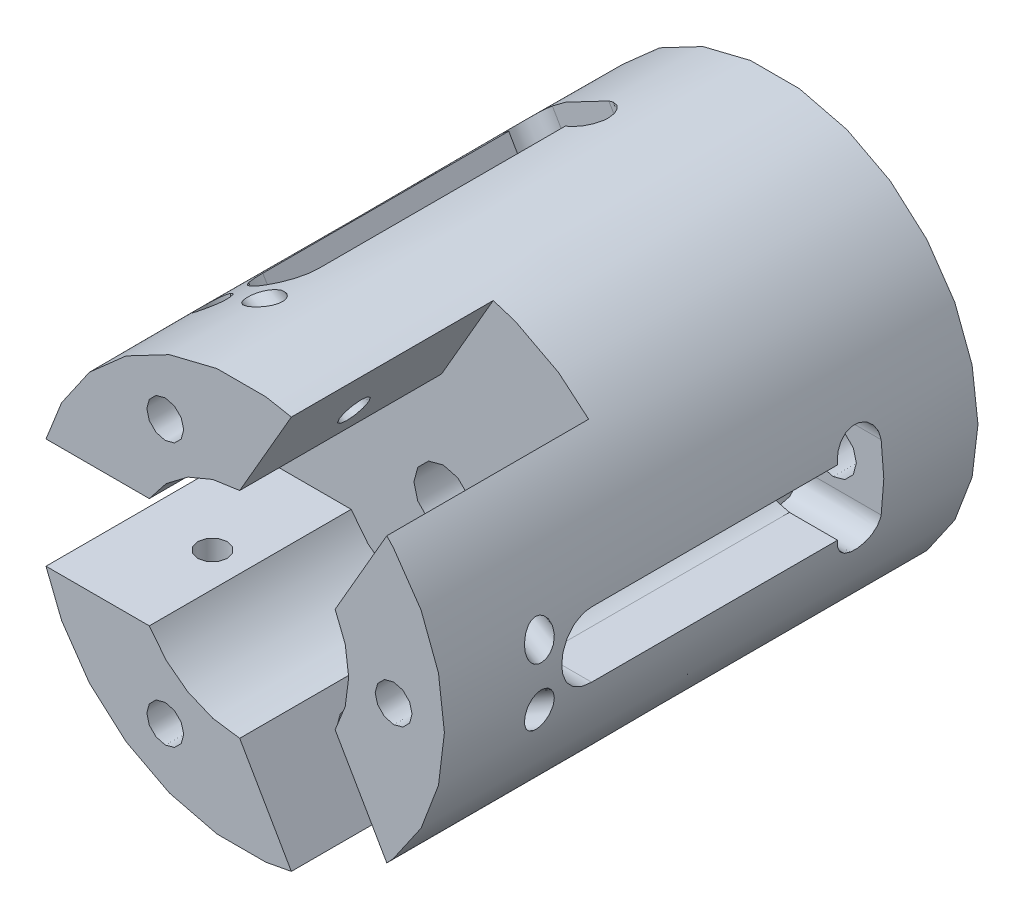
SolidWorks part; units mm, degrees
ref_plane "Front Plane" through (0, 0, 0) normal (0, 0, 1) x (1, 0, 0)
ref_plane "Top Plane" through (0, 0, 0) normal (0, 1, 0) x (1, 0, 0)
ref_plane "Right Plane" through (0, 0, 0) normal (1, 0, 0) x (0, 0, -1)
sketch "Sketch1" plane through (0, 0, 0) normal (0, 0, 1) x (1, 0, 0)
  circle A0 centre (0, 0) radius 22.225
  dimension "D1" = 44.45
extrude "Extrude1" add sketch "Sketch1" along normal blind 58.42
sketch "Sketch2" plane through (0, 0, 58.42) normal (0, 0, 1) x (1, 0, 0)
  line L1 (-24.77, 6.0325) -> (-3.8154, 6.0325)
  line L2 (-24.77, 6.0325) -> (-24.77, -6.0325)
  line L3 (-24.77, -6.0325) -> (-3.8154, -6.0325)
  line L4 (-3.8154, 6.0325) -> (-3.8154, -6.0325)
  dimension "D1" = 6.0325
  dimension "D2" = 12.065
extrude "Cut-Extrude1" cut sketch "Sketch2" against normal blind 22.098
pattern_circular "CirPattern1" count 3 over 360 about axis through (0, 0, 0) along (0, 0, 1) of "Cut-Extrude1"
sketch "Sketch3" plane through (0, 0, 58.42) normal (0, 0, 1) x (1, 0, 0)
  circle A0 centre (0, 0) radius 11.7475
  dimension "D1" = 23.495
extrude "Cut-Extrude2" cut sketch "Sketch3" against normal blind 22.098
hole_wizard "#10-32 Tapped Hole1" positions "Sketch5" profile "Sketch4" tap size "#10-32" standard "Ansi Inch"
sketch "Sketch5" plane through (0, 0, 58.42) normal (0, 0, 1) x (1, 0, 0)
  point P0 (16.6687, 0)
  dimension "D1" = 16.6687
sketch "Sketch4" plane through (16.6687, 0, 58.42) normal (1, 0, 0) x (0, -1, 0)
  line L0 (0, 0) -> (0, 26.6133)
  line L1 (0, 26.6133) -> (2.0193, 25.4)
  line L2 (2.0193, 25.4) -> (2.0193, 0)
  line L5 (2.0193, 0) -> (0, 0)
  line L10 (0, 26.6133) -> (-2.0193, 25.4) construction
  line L11 (0, -6.35) -> (0, 107.95) construction
  dimension "Tap Drill Dia." = 4.0386
  dimension "Tap Drill Depth" = 25.4
  dimension "Drill Angle" = 118
pattern_circular "CirPattern2" count 3 over 360 about axis through (0, 0, 0) along (0, 0, 1) of "#10-32 Tapped Hole1"
hole_wizard "3/16 (0.1875) Diameter Hole1" positions "Sketch9" profile "Sketch8" hole size "3/16" standard "Ansi Inch"
sketch "Sketch9" plane through (0, 0, 0) normal (0, 0, -1) x (-1, 0, 0)
  line L0 (0, 24.4475) -> (0, -24.4475) construction
  point P0 (0, 16.6687)
  dimension "D1" = 16.6687
sketch "Sketch8" plane through (0, 16.6687, 0) normal (1, 0, 0) x (0, 1, 0)
  line L0 (0, 0) -> (0, 10.9558)
  line L1 (0, 10.9558) -> (2.3812, 9.525)
  line L2 (2.3812, 9.525) -> (2.3812, 0)
  line L5 (2.3812, 0) -> (0, 0)
  line L10 (0, 10.9558) -> (-2.3812, 9.525) construction
  line L11 (0, -50.8) -> (0, 50.8) construction
  dimension "Hole Dia." = 4.7625
  dimension "Hole Depth" = 9.525
  dimension "Drill Angle" = 118
pattern_circular "CirPattern3" count 2 every 180 about axis through (0, 0, 0) along (0, 0, 1) of "3/16 (0.1875) Diameter Hole1"
sketch "Sketch10" plane through (0, 0, 0) normal (0, 0, -1) x (-1, 0, 0)
  circle A0 centre (0, 0) radius 9.906
  dimension "D1" = 19.812
extrude "Cut-Extrude3" cut sketch "Sketch10" against normal blind 26.162
sketch "Sketch11" plane through (0, 0, 0) normal (0, 0, -1) x (-1, 0, 0)
  circle A0 centre (0, 0) radius 10.287
  dimension "D1" = 20.574
extrude "Cut-Extrude4" cut sketch "Sketch11" against normal blind 5.1562
sketch "Sketch31" plane through (0, 0, 0) normal (0, 0, 1) x (1, 0, 0)
  line L0 (0, 0) -> (-23.0463, 0) construction
  line L1 (0, 0) -> (-21.1916, 8.7779) construction
  line L2 (0, 0) -> (-20.9149, -8.6632) construction
  line L3 (0, -10.7242) -> (0, 14.5921) construction
  line L4 (-12.7762, -7.2367) -> (-12.7762, 11.1119) construction
  circle A0 centre (-12.7762, -5.2921) radius 2.0447
  circle A1 centre (-12.7762, 5.2921) radius 2.0447
  point P2 (-12.7762, 5.2921)
  point P9 (-12.7762, -5.2921)
  dimension "D3" = 4.0894
  dimension "D5" = 4.0894
  dimension "D1" = 22.5
  dimension "D2" = 22.5
  dimension "D4" = 12.7762
extrude "Cut-Extrude19" cut sketch "Sketch31" along normal blind 34.925
sketch "Sketch33" plane through (0, 0, 0) normal (0, 0, 1) x (1, 0, 0)
  line L0 (-13.5884, 3.9102) -> (-23.1832, 7.8845)
  line L1 (-23.1832, 7.8845) -> (-21.9682, 10.8178)
  line L2 (-12.3734, 6.8435) -> (-13.5884, 3.9102)
  line L3 (-21.9682, 10.8178) -> (-12.3734, 6.8435)
  line L4 (0, 0) -> (-21.1916, 8.7779) construction
  line L5 (-13.7282, -3.9681) -> (-23.2875, -7.9277)
  line L6 (-23.2875, -7.9277) -> (-22.2551, -10.9366)
  line L7 (-22.2551, -10.9366) -> (-12.5132, -6.9014)
  line L8 (-12.5132, -6.9014) -> (-13.7282, -3.9681)
  line L9 (0, 0) -> (-20.9149, -8.6632) construction
  dimension "D1" = 3.175
  dimension "D2" = 1.5875
  dimension "D3" = 3.175
  dimension "D4" = 1.5875
extrude "Cut-Extrude20" cut sketch "Sketch33" along normal blind 34.925
sketch "Sketch34" plane through (0, 0, 0) normal (0, 0, 1) x (1, 0, 0)
  line L0 (-13.5924, 9.0667) -> (-16.0224, 3.2001)
  line L1 (-16.0224, 3.2001) -> (-26.7234, 7.6326)
  line L2 (-26.7234, 7.6326) -> (-24.2934, 13.4992)
  line L3 (-24.2934, 13.4992) -> (-13.5924, 9.0667)
  line L4 (0, 0) -> (-21.1916, 8.7779) construction
  line L5 (-16.1134, -3.2378) -> (-13.6833, -9.1044)
  line L6 (-13.6833, -9.1044) -> (-24.3816, -13.5358)
  line L7 (-24.3816, -13.5358) -> (-26.8117, -7.6692)
  line L8 (-26.8117, -7.6692) -> (-16.1134, -3.2378)
  line L9 (0, 0) -> (-20.9149, -8.6632) construction
  dimension "D1" = 16.0274
  dimension "D2" = 6.35
  dimension "D3" = 6.35
  dimension "D4" = 3.175
  dimension "D5" = 3.175
extrude "Cut-Extrude22" cut sketch "Sketch34" along normal blind 34.925
sketch "Sketch18" plane through (0, 0, 0) normal (0, 1, 0) x (1, 0, 0)
  line L0 (-21.3906, -58.42) -> (5.471, -58.42) construction
  circle A0 centre (-13.8176, -47.7774) radius 1.6129
  dimension "D1" = 3.2258
  dimension "D2" = 10.6426
  dimension "D3" = 13.8176
extrude "Cut-Extrude9" cut sketch "Sketch18" against normal through all and the other way through all
pattern_circular "CirPattern4" count 3 over 360 about axis through (0, 0, 58.42) along (0, 0, -1) of "Cut-Extrude9"
ref_plane "Plane1" through (0, 0, 0.762) normal (0, 0, 1) x (1, 0, 0)
sketch "Sketch20" plane through (0, 0, 0.762) normal (0, 0, -1) x (-1, 0, 0)
  circle A0 centre (0, 0) radius 10.8204
  dimension "D1" = 21.6408
extrude "Cut-Extrude11" cut sketch "Sketch20" against normal blind 0.6604
sketch "Sketch22" plane through (0, 0, 26.162) normal (0, 0, -1) x (-1, 0, 0)
  circle A0 centre (0, 0) radius 7.1374
  dimension "D1" = 14.2748
extrude "Cut-Extrude12" cut sketch "Sketch22" against normal blind 1.905
sketch "Sketch23" plane through (0, 0, 26.162) normal (0, 0, -1) x (-1, 0, 0)
  circle A0 centre (0, 0) radius 4.7752
  dimension "D1" = 9.5504
extrude "Cut-Extrude13" cut sketch "Sketch23" against normal blind 3.81
sketch "Sketch24" plane through (0, 0, 26.162) normal (0, 0, -1) x (-1, 0, 0)
  circle A0 centre (0, 0) radius 3.2131
  dimension "D1" = 6.4262
extrude "Cut-Extrude14" cut sketch "Sketch24" against normal through all
ref_plane "Plane2" through (13.1064, 0, 0) normal (1, 0, 0) x (0, 0, -1)
sketch "Sketch25" plane through (13.1064, 0, 0) normal (1, 0, 0) x (0, 0, -1)
  line L0 (0, -3.2474) -> (0, -7.3368) construction
  line L2 (-15.0876, -3.5687) -> (-15.0876, 3.5687)
  line L4 (-10.3124, 3.5687) -> (-10.3124, -3.5687)
  line L5 (-58.42, 0) -> (-36.322, 0) construction
  arc A0 (-15.0876, 3.5687) -> (-10.3124, 3.5687) centre (-12.7, 3.5687) cw
  arc A1 (-10.3124, -3.5687) -> (-15.0876, -3.5687) centre (-12.7, -3.5687) cw
  dimension "D1" = 3.5687
  dimension "D2" = 7.1374
  dimension "D3" = 4.7752
  dimension "D4" = 12.7
extrude "Cut-Extrude15" cut sketch "Sketch25" along normal through all
sketch "Sketch26" plane through (0, 0, 15.0876) normal (0, 0, -1) x (-1, 0, 0)
  line L0 (-16.6687, 3.5687) -> (-33.1071, 3.5687)
  line L1 (-19.681, 3.5687) -> (-13.4164, 3.5687) construction
  line L2 (-16.6687, -3.5687) -> (-33.1071, -3.5687)
  line L3 (-19.681, -3.5687) -> (-13.4164, -3.5687) construction
  line L4 (-33.1071, 3.5687) -> (-33.1071, -3.5687)
  arc A0 (-16.6687, -3.5687) -> (-16.6687, 3.5687) centre (-16.6687, 0) ccw
  dimension "D1" = 3.5687
extrude "Cut-Extrude16" cut sketch "Sketch26" against normal blind 30.48
fillet "Fillet1" radius 3.556 3 edges at (19.3027, -3.5687, 45.5676) (19.3027, 3.5687, 45.5676) (13.1001, 0, 45.5676)
pattern_circular "CirPattern5" count 3 over 360 about axis through (0, 0, 58.42) along (0, 0, -1) of "Cut-Extrude16", "Cut-Extrude15", "Fillet1"
hole_wizard "1/4-20 Tapped Hole2" positions "Sketch29" profile "Sketch28" tap size "1/4-20" standard "Ansi Inch"
sketch "Sketch29" plane through (0, 0, 0) normal (0, 0, -1) x (-1, 0, 0)
  point P1 (-16.6687, 0)
  point P2 (8.3344, 14.4356)
  point P4 (8.3344, -14.4356)
sketch "Sketch28" plane through (16.6687, 0, 0) normal (1, 0, 0) x (0, 1, 0)
  line L0 (0, 0) -> (0, 18.0438)
  line L1 (0, 18.0438) -> (2.5527, 16.51)
  line L2 (2.5527, 16.51) -> (2.5527, 0)
  line L5 (2.5527, 0) -> (0, 0)
  line L10 (0, 18.0438) -> (-2.5527, 16.51) construction
  line L11 (0, -6.35) -> (0, 107.95) construction
  dimension "Tap Drill Dia." = 5.1054
  dimension "Tap Drill Depth" = 16.51
  dimension "Drill Angle" = 118
fillet "Fillet10" radius 3.556 1 edges at (-16.35, 10.209, 34.925)
fillet "Fillet11" radius 3.556 1 edges at (-18.78, 4.3423, 34.925)
fillet "Fillet12" radius 3.556 1 edges at (-16.3955, -10.2278, 34.925)
fillet "Fillet13" radius 3.556 1 edges at (-18.8255, -4.3612, 34.925)
